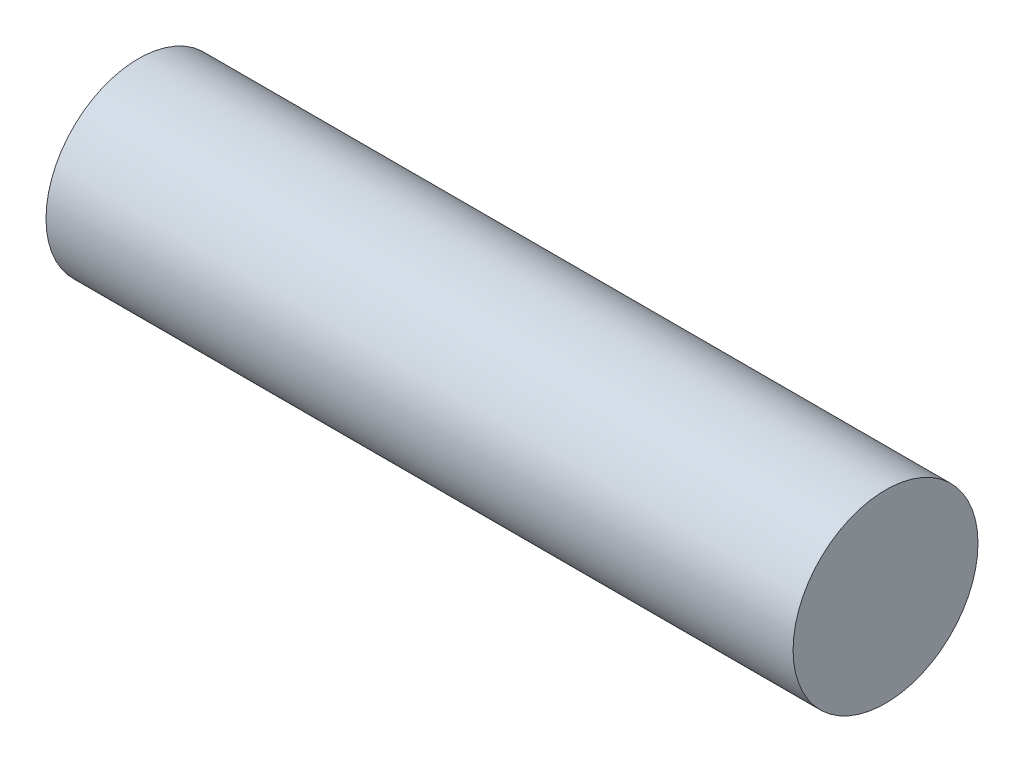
SolidWorks part; units mm, degrees
ref_plane "Front Plane" through (0, 0, 0) normal (1, 0, 0) x (0, 1, 0)
ref_plane "Top Plane" through (0, 0, 0) normal (0, 0, 1) x (0, 1, 0)
ref_plane "Right Plane" through (0, 0, 0) normal (0, 1, 0) x (-1, 0, 0)
sketch "Sketch2" plane through (0, 0, 0) normal (1, 0, 0) x (0, 1, 0)
  circle A0 centre (0, 0) radius 3.175
extrude "Boss-Extrude1" add sketch "Sketch2" along normal blind 25.4 and the other way blind 0.254
equation "\"D1@Boss-Extrude1\"=1.00in"
equation "\"D1@Sketch2\"=0.25in"
